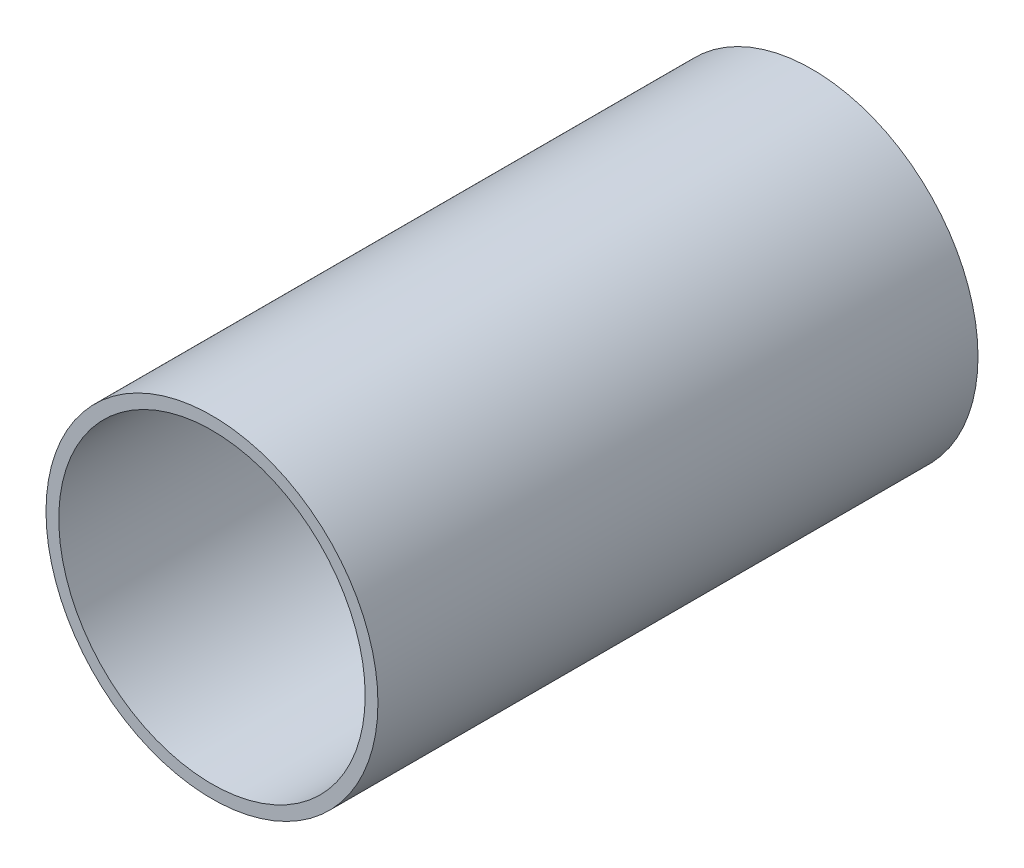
SolidWorks part; units mm, degrees
ref_plane "Front Plane" through (0, 0, 0) normal (0, 0, 1) x (1, 0, 0)
ref_plane "Top Plane" through (0, 0, 0) normal (0, 1, 0) x (1, 0, 0)
ref_plane "Right Plane" through (0, 0, 0) normal (1, 0, 0) x (0, 0, -1)
sketch "Sketch1" plane through (0, 0, 0) normal (0, 0, 1) x (1, 0, 0)
  circle A0 centre (0, 0) radius 82.55
  circle A1 centre (0, 0) radius 76.2
  dimension "D1" = 165.1
  dimension "D2" = 152.4
extrude "Boss-Extrude1" add sketch "Sketch1" along normal mid plane 298.45
